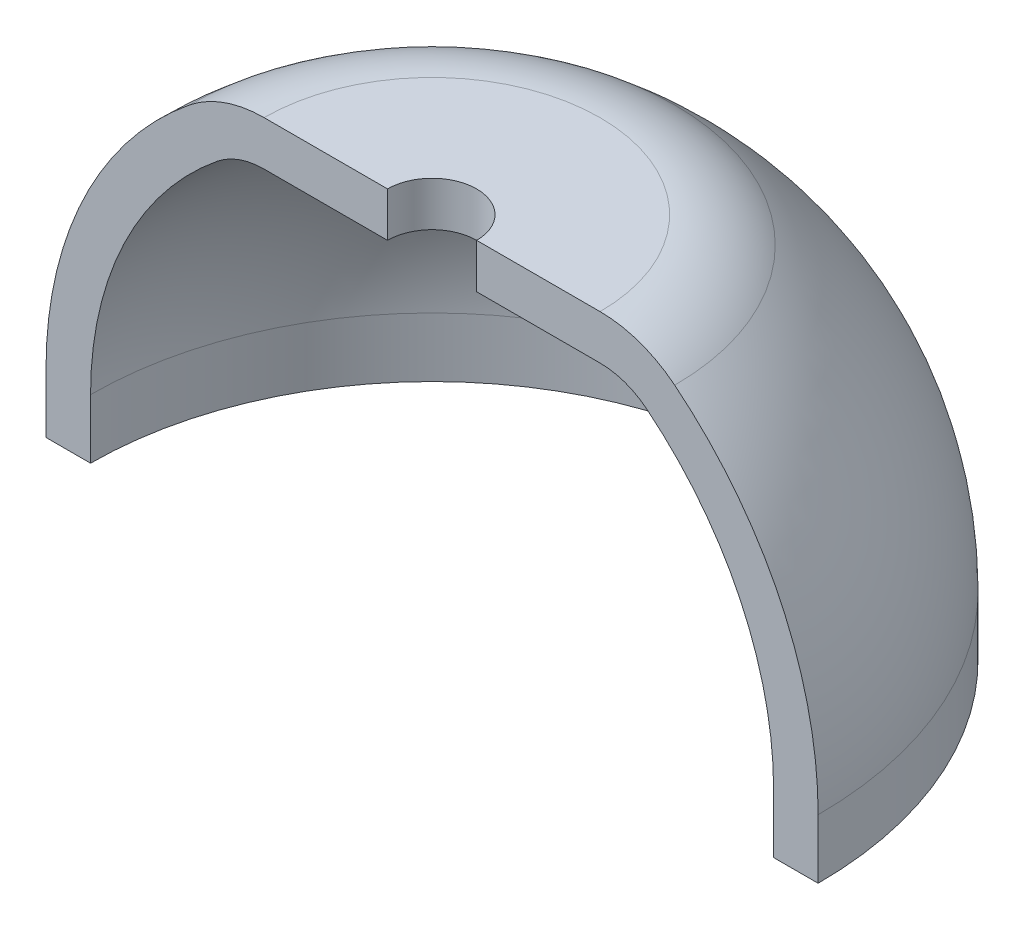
SolidWorks part; units mm, degrees
ref_plane "Face" through (0, 0, 0) normal (0, 0, 1) x (1, 0, 0)
ref_plane "Dessus" through (0, 0, 0) normal (0, 1, 0) x (1, 0, 0)
ref_plane "Droite" through (0, 0, 0) normal (1, 0, 0) x (0, 0, -1)
sketch "Esquisse1" plane through (0, 0, 0) normal (0, 0, 1) x (1, 0, 0)
  line L0 (13, 0) -> (13, -2)
  line L1 (11.5, 0) -> (11.5, -2)
  line L2 (11.5, -2) -> (13, -2)
  line L3 (0, 11) -> (0, 9.5)
  line L4 (0, 11) -> (5.6569, 11)
  line L5 (0, 9.5) -> (5.6569, 9.5)
  line L6 (0, 9.5) -> (0, 0) construction
  arc A0 (13, 0) -> (8.171, 10.1111) centre (0, 0) ccw
  arc A1 (11.5, 0) -> (7.2282, 8.9444) centre (0, 0) ccw
  arc A2 (5.6569, 9.5) -> (7.2282, 8.9444) centre (5.6569, 7) cw
  arc A3 (5.6569, 11) -> (8.171, 10.1111) centre (5.6569, 7) cw
  dimension "D1" = 13
  dimension "D2" = 4
  dimension "D3" = 1.5
  dimension "D4" = 13
  dimension "D6" = 2
revolve "Révolution1" add sketch "Esquisse1" angle 360 about L6
sketch "Esquisse2" plane through (0, 11, 0) normal (0, 1, 0) x (-1, 0, 0)
  circle A0 centre (0, 0) radius 1.5
  circle A1 centre (0, 0) radius 13 construction
  dimension "D1" = 3
extrude "Enlèv. mat.-Extru.1" cut sketch "Esquisse2" against normal up to next
sketch "Esquisse3" plane through (0, 11, 0) normal (0, 1, 0) x (-1, 0, 0)
  line L1 (17.8355, 0) -> (-16.8664, 0)
  line L2 (17.8355, 0) -> (17.8355, 15.04)
  line L3 (17.8355, 15.04) -> (-16.8664, 15.04)
  line L4 (-16.8664, 0) -> (-16.8664, 15.04)
extrude "Coupe" cut sketch "Esquisse3" against normal through all
